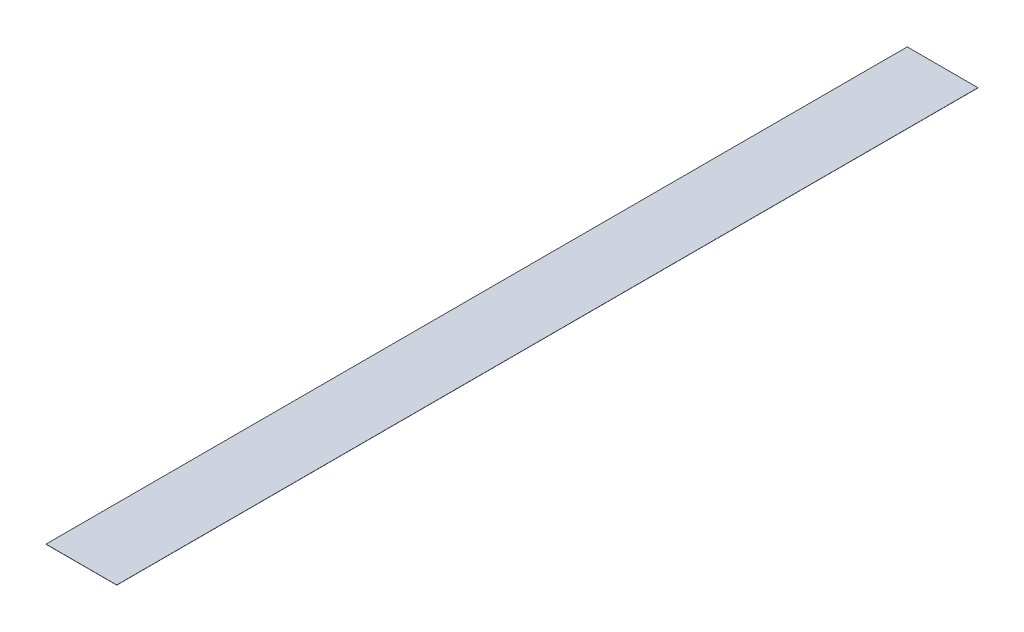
SolidWorks part; units mm, degrees
ref_plane "Front" through (0, 0, 0) normal (0, 0, 1) x (1, 0, 0)
ref_plane "Top" through (0, 0, 0) normal (0, 1, 0) x (1, 0, 0)
ref_plane "Right" through (0, 0, 0) normal (1, 0, 0) x (0, 0, -1)
sketch "Sketch1" plane through (0, 0, 0) normal (0, 1, 0) x (1, 0, 0)
  line L0 (12.3027, 149.75) -> (-12.3027, -149.75) construction
  line L1 (-12.3027, 149.75) -> (12.3027, 149.75)
  line L2 (-12.3027, 149.75) -> (-12.3027, -149.75)
  line L3 (-12.3027, -149.75) -> (12.3027, -149.75)
  line L4 (12.3027, 149.75) -> (12.3027, -149.75)
  point P4 (0, 0)
  dimension "D1" = 299.5
  dimension "D2" = 24.6054
extrude "Extrude1" add sketch "Sketch1" along normal blind 0.0508
